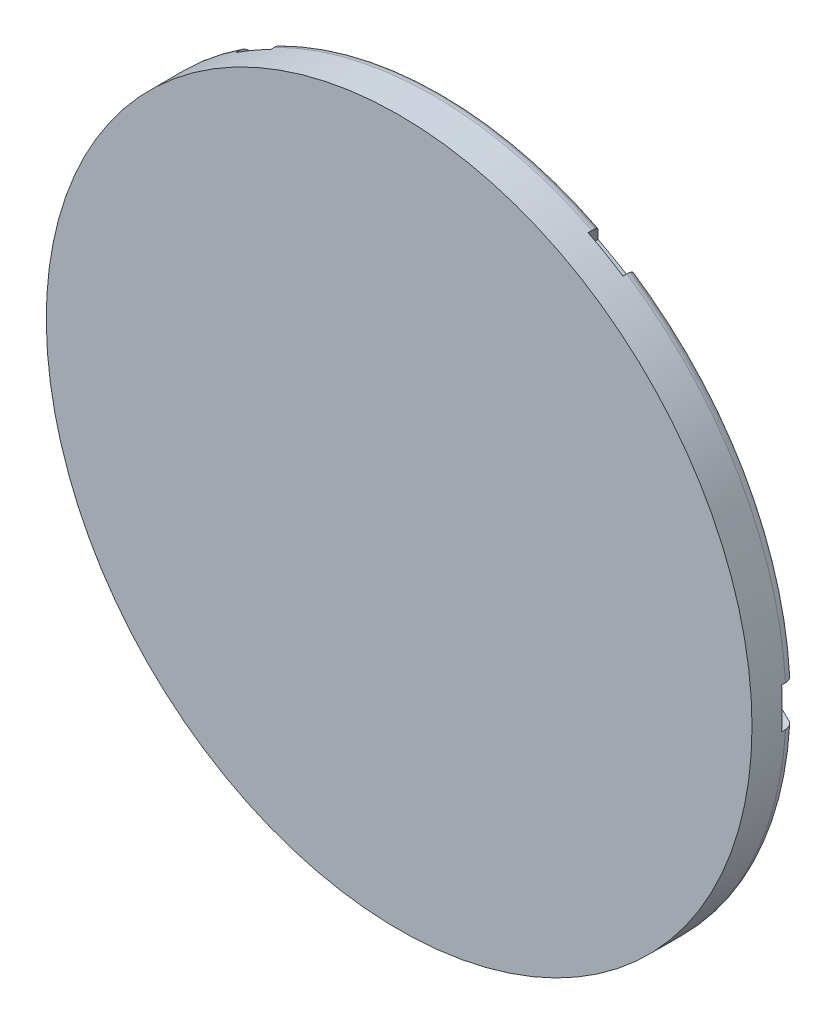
SolidWorks part; units mm, degrees
ref_plane "Front" through (0, 0, 0) normal (0, 0, 1) x (1, 0, 0)
ref_plane "Top" through (0, 0, 0) normal (0, 1, 0) x (1, 0, 0)
ref_plane "Right" through (0, 0, 0) normal (1, 0, 0) x (0, 0, -1)
sketch "Sketch1" plane through (0, 0, 0) normal (0, 0, 1) x (1, 0, 0)
  circle A0 centre (0, 0) radius 17.5
  dimension "D1" = 35
extrude "Base-Extrude" add sketch "Sketch1" along normal blind 2
chamfer "Chamfer1" distance 2 distance2 1 1 edges at (17.5, 0, 0)
fillet "Fillet8" radius 0.5 2 edges at (17.5, 0, 1) (15.5, 0, 0)
sketch "Sketch2" plane through (0, 0, 0) normal (0, 0, -1) x (-1, 0, 0)
  line L0 (-53.4466, 0) -> (62.2609, 0) construction
  line L1 (0, 53.8727) -> (0, -50.6863) construction
  line L3 (16, 1) -> (20, 1)
  line L4 (16, 1) -> (16, -1)
  line L5 (16, -1) -> (20, -1)
  line L6 (20, 1) -> (20, -1)
  circle A0 centre (0, 0) radius 17.5 construction
  circle A1 centre (0, 0) radius 17.5 construction
  point P11 (16, 0)
  dimension "D1" = 16
  dimension "D2" = 20
  dimension "D3" = 2
extrude "Cut-Extrude1" cut sketch "Sketch2" against normal blind 1.5
pattern_circular "CirPattern1" count 6 over 360 about axis through (0, 0, 0) along (0, 0, 1) of "Cut-Extrude1"
sketch "Sketch3" plane through (0, 0, 2) normal (0, 0, 1) x (1, 0, 0)
  circle A1 centre (0, 0) radius 17.5
  circle A2 centre (0, 0) radius 17.5
  dimension "D1" = 0
extrude "Boss-Extrude1" add sketch "Sketch3" along normal blind 1
